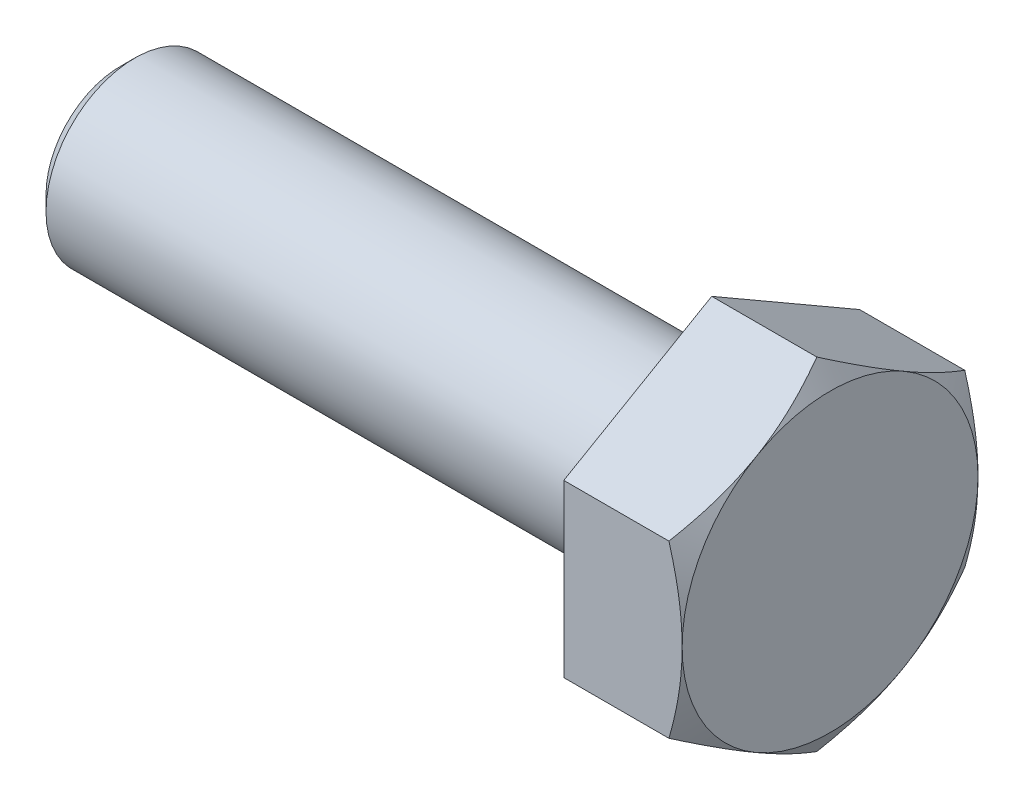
SolidWorks part; units mm, degrees
ref_plane "Plan1" through (0, 0, 0) normal (0, 0, 1) x (1, 0, 0)
ref_plane "Plan2" through (0, 0, 0) normal (0, 1, 0) x (1, 0, 0)
ref_plane "Plan3" through (0, 0, 0) normal (1, 0, 0) x (0, 0, -1)
sketch "Esquisse1" plane through (0, 0, 0) normal (0, 0, 1) x (1, 0, 0)
  line L0 (0, 0) -> (-20, 0)
  line L1 (-20, 0) -> (-20, 3)
  line L2 (-20, 3) -> (0, 3)
  line L3 (0, 3) -> (0, 0)
  line L4 (-110, 0) -> (30, 0) construction
  dimension "D1" = 20
  dimension "D2" = 3
revolve "Tige" add sketch "Esquisse1"
chamfer "Chanfrein de tige" distance 0.5 angle 45
sketch "Esquisse2" plane through (0, 0, 0) normal (1, 0, 0) x (0, 0, -1)
  line L0 (0, 5.7735) -> (5, 2.8868)
  line L1 (5, 2.8868) -> (5, -2.8868)
  line L2 (5, -2.8868) -> (0, -5.7735)
  line L3 (0, -5.7735) -> (-5, -2.8868)
  line L4 (-5, -2.8868) -> (-5, 2.8868)
  line L5 (-5, 2.8868) -> (0, 5.7735)
  line L6 (0, 5.7735) -> (0, 0) construction
  line L7 (0, 0) -> (5, 2.8868) construction
  line L8 (0, 0) -> (5, -2.8868) construction
  line L9 (0, 0) -> (0, -5.7735) construction
  line L10 (0, 0) -> (-5, -2.8868) construction
  line L11 (0, 0) -> (-5, 2.8868) construction
  dimension "D1" = 10
extrude "Tête" add sketch "Esquisse2" along normal blind 4
sketch "Esquisse3" plane through (4, 0, 0) normal (1, 0, 0) x (0, 0, -1)
  line L0 (5, 2.8868) -> (5, -2.8868) construction
  circle A0 centre (0, 0) radius 5
sketch "Esquisse4" plane through (0, 0, 0) normal (0, 0, 1) x (1, 0, 0)
  line L0 (3.5534, 5.7735) -> (4, 5.7735)
  line L1 (4, 5.7735) -> (4, 5)
  line L2 (4, 5) -> (3.5534, 5.7735)
  line L3 (4, -5) -> (4, 5) construction
  line L4 (4, 5.7735) -> (0, 5.7735) construction
  line L5 (16, 0) -> (-7, 0) construction
  line L6 (-110, 0) -> (30, 0) construction
  dimension "D1" = 30
revolve "Chanfrein de tête" cut sketch "Esquisse4" angle 360 about L5
